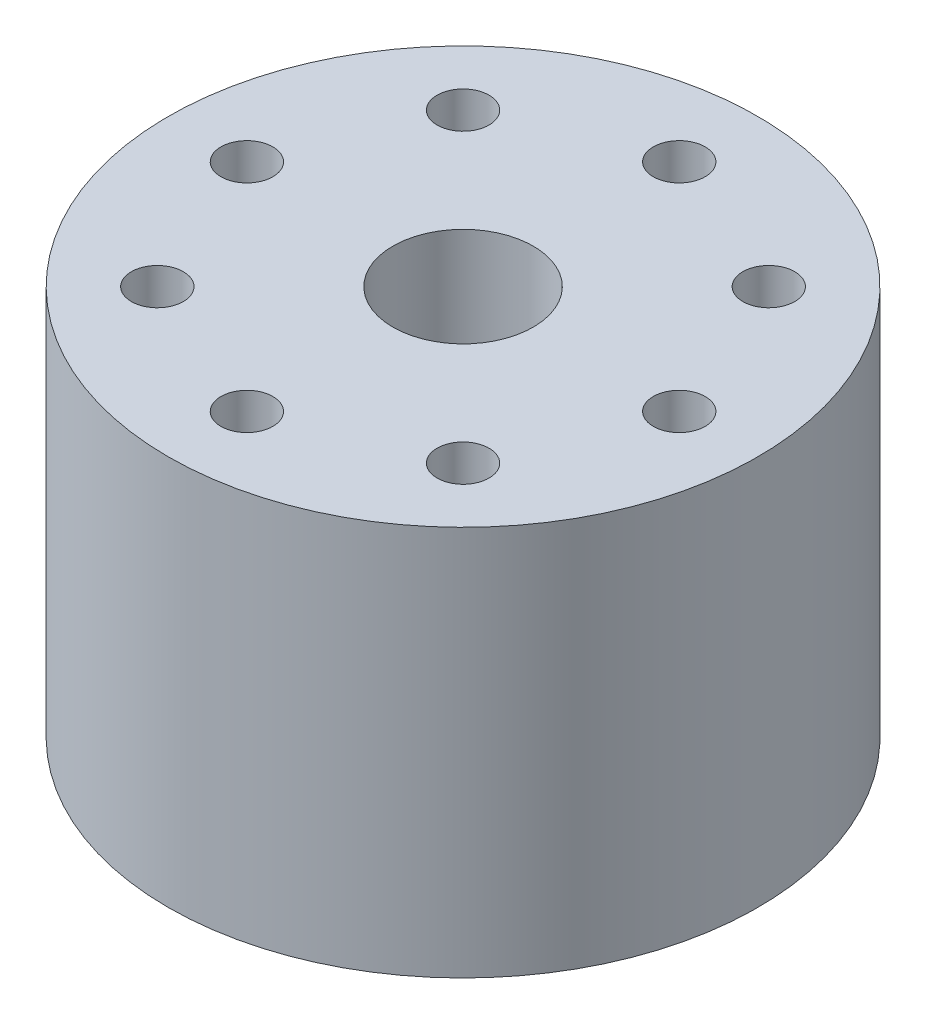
SolidWorks part; units mm, degrees
ref_plane "Front Plane" through (0, 0, 0) normal (0, 0, 1) x (1, 0, 0)
ref_plane "Top Plane" through (0, 0, 0) normal (0, 1, 0) x (1, 0, 0)
ref_plane "Right Plane" through (0, 0, 0) normal (1, 0, 0) x (0, 0, -1)
sketch "Sketch1" plane through (0, 0, 0) normal (0, 1, 0) x (1, 0, 0)
  circle A0 centre (0, 0) radius 37.5
  dimension "D1" = 75
extrude "Outer Cylinder" add sketch "Sketch1" along normal blind 49.65
sketch "Sketch2" plane through (0, 49.65, 0) normal (0, 1, 0) x (1, 0, 0)
  circle A0 centre (0, 0) radius 8.93
  dimension "D1" = 17.86
extrude "NPT Hole" cut sketch "Sketch2" against normal blind 23
sketch "Sketch3" plane through (0, 0, 0) normal (0, -1, 0) x (1, 0, 0)
  circle A0 centre (0, 0) radius 6
  dimension "D1" = 12
extrude "Outer Leaflet Diameter" cut sketch "Sketch3" against normal blind 5
sketch "Sketch4" plane through (0, 0, 0) normal (0, -1, 0) x (1, 0, 0)
  circle A0 centre (0, 0) radius 10
  dimension "D1" = 20
extrude "Depth" cut sketch "Sketch4" against normal blind 3.15
ref_plane "Plane1" through (0, 3.15, 0) normal (0, -1, 0) x (-1, 0, 0)
sketch "Sketch6" plane through (0, 0, 0) normal (0, 0, 1) x (1, 0, 0)
  line L0 (0, 3.15) -> (-6, 3.15)
  line L1 (-10, 3.15) -> (10, 3.15) construction
  line L2 (0, 3.15) -> (0, 11.67)
  line L3 (0, 11.67) -> (-6, 11.67)
  spline S0 degree 2 poles (-6, 11.67) (-9.6, 7.41) (-6, 3.15) knots 0 0 0 1 1 1
revolve "Aortic Root" cut sketch "Sketch6" angle 360 about L2
ref_plane "Plane3" through (0, 26.65, 0) normal (0, 1, 0) x (1, 0, 0)
ref_plane "Plane5" through (0, 11.67, 0) normal (0, -1, 0) x (-1, 0, 0)
sketch "Sketch8" plane through (0, 0, 0) normal (0, 0, 1) x (1, 0, 0)
  line L0 (0, 26.65) -> (0, 11.67)
  line L1 (8.93, 26.65) -> (-8.93, 26.65) construction
  line L2 (-6, 11.67) -> (6, 11.67) construction
  line L3 (0, 11.67) -> (-6, 11.67)
  line L4 (-6, 11.67) -> (-6, 26.65)
  line L5 (-6, 26.65) -> (0, 26.65)
revolve "Ascending Aorta" cut sketch "Sketch8" angle 360 about L0
sketch "Sketch9" plane through (0, 49.65, 0) normal (0, 1, 0) x (1, 0, 0)
  line L0 (0, 0) -> (0, -27.5) construction
  line L1 (0, 0) -> (-19.4454, -19.4454) construction
  circle A0 centre (0, -27.5) radius 3.3
  circle A1 centre (0, 0) radius 27.5
  circle A2 centre (-19.4454, -19.4454) radius 3.3
  circle A3 centre (-27.5, 0) radius 3.3
  circle A4 centre (-19.4454, 19.4454) radius 3.3
  circle A5 centre (0, 27.5) radius 3.3
  circle A6 centre (19.4454, 19.4454) radius 3.3
  circle A7 centre (27.5, 0) radius 3.3
  circle A8 centre (19.4454, -19.4454) radius 3.3
  dimension "D1" = 6.6
  dimension "D3" = 55
  dimension "D2" = 27.5
  dimension "D5" = 45
  dimension "D4" = 8
extrude "Bolt Holes" cut sketch "Sketch9" against normal through all contours A1 A8 | A1 A7 | A1 A6 | A1 A6 | A1 A5 | A1 A5 | A1 A4 | A1 A4 | A1 A3 | A1 A3 | A1 A2 | A1 A2 | A0 A1 | A1 A0 | A1 A8
chamfer "Chamfer1" distance 2 angle 70 1 edges at (-6, 26.65, 0)
equation "\"A\"= 12"
equation "\"Outer Leaflet Diameter\"= \"A\""
equation "\"Aortic Root Height\"= .71 * \"A\""
equation "\"D2@Sketch6\"=\"A\"/2"
equation "\"D3@Sketch6\"= \"A\" / 2"
equation "\"Max Diameter Height\"= \"A\" * ( .71 / 2 )"
equation "\"Max Diameter\"= \"A\" * ( .65 )"
equation "\"D2@Sketch8\"=\"A\"/2"
